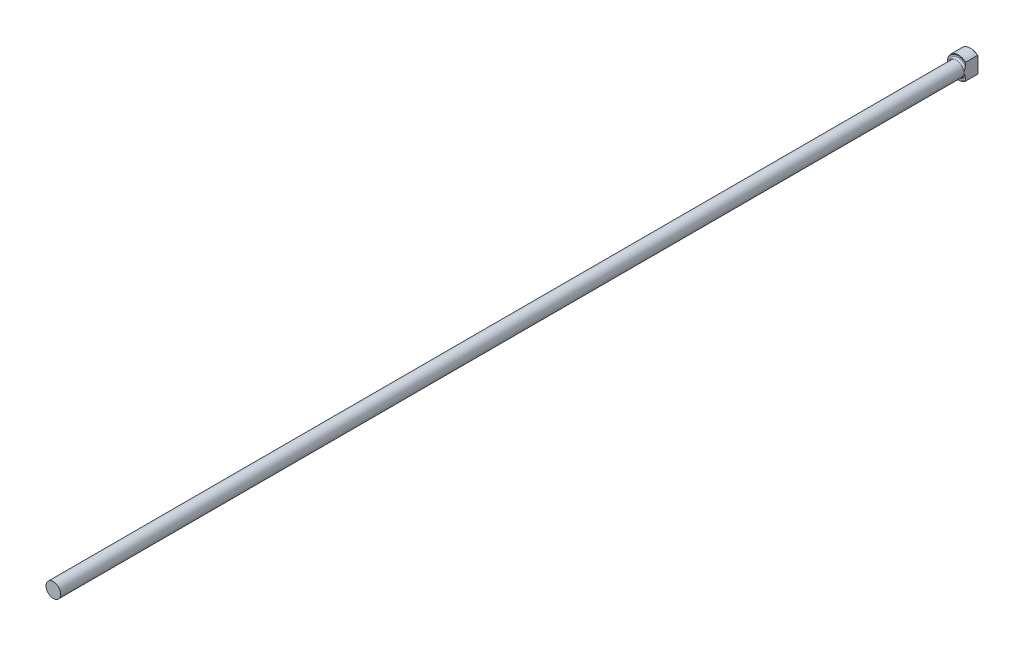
SolidWorks part; units mm, degrees
ref_plane "Front Plane" through (0, 0, 0) normal (0, 0, 1) x (1, 0, 0)
ref_plane "Top Plane" through (0, 0, 0) normal (0, 1, 0) x (1, 0, 0)
ref_plane "Right Plane" through (0, 0, 0) normal (1, 0, 0) x (0, 0, -1)
sketch "Sketch1" plane through (0, 0, 0) normal (1, 0, 0) x (0, 0, -1)
  line L0 (0, 0) -> (0, 5.461)
  line L1 (0, 5.461) -> (-6.35, 5.461)
  line L2 (-6.35, 5.461) -> (-6.35, 4.3967)
  line L3 (-7.112, 3.6347) -> (-457.2, 3.6347)
  line L4 (-457.2, 3.6347) -> (-457.2, 0)
  line L5 (-457.2, 0) -> (0, 0)
  line L6 (25.4347, 0) -> (-130.6739, 0) construction
  arc A0 (-6.35, 4.3967) -> (-7.112, 3.6347) centre (-7.112, 4.3967) cw
  dimension "D4" = 0.762
  dimension "D1" = 7.2695
  dimension "D2" = 10.922
  dimension "D3" = 6.35
  dimension "D5" = 457.2
revolve "Revolve1" add sketch "Sketch1" angle 360 about L6
chamfer "Chamfer1" distance 0.254 angle 45 2 edges at (-5.461, 0, 0) (-5.461, 0, 6.35)
sketch "Sketch2" plane through (0, 0, 0) normal (0, 0, -1) x (-1, 0, 0)
  line L1 (-3.6347, 4.0757) -> (-3.6347, -4.0757)
  circle A1 centre (0, 0) radius 5.461 construction
  circle A2 centre (0, 0) radius 3.6347 construction
  arc A5 (-3.6347, -4.0757) -> (-3.6347, 4.0757) centre (0, 0) cw
extrude "Cut-Extrude1" cut sketch "Sketch2" against normal up to next
